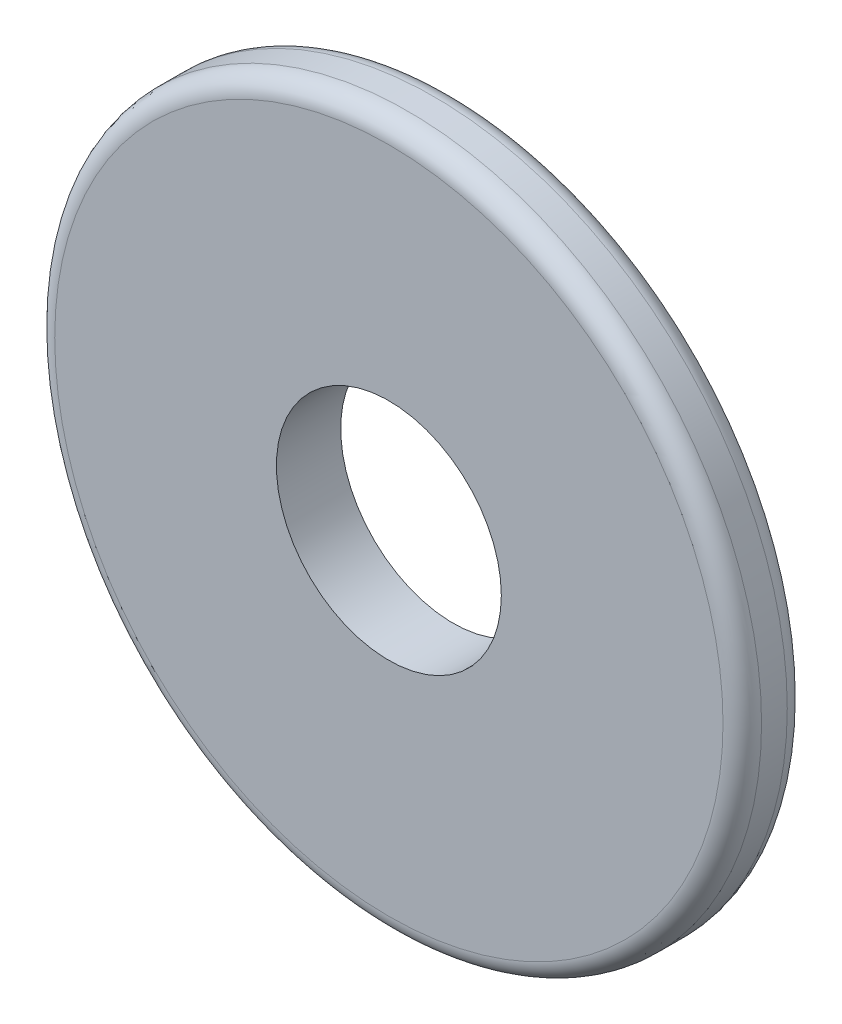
SolidWorks part; units mm, degrees
ref_plane "Plan1" through (0, 0, 0) normal (0, 0, 1) x (1, 0, 0)
ref_plane "Plan2" through (0, 0, 0) normal (0, 1, 0) x (1, 0, 0)
ref_plane "Plan3" through (0, 0, 0) normal (1, 0, 0) x (0, 0, -1)
sketch "Esquisse1" plane through (0, 0, 0) normal (0, 0, 1) x (1, 0, 0)
  circle A0 centre (0, 0) radius 5.5
  circle A1 centre (0, 0) radius 1.75
  dimension "D1" = 3.5
  dimension "D2" = 11
extrude "Base-Extrusion" add sketch "Esquisse1" along normal blind 1
fillet "Congé1" radius 0.3 2 edges at (5.5, 0, 0) (5.5, 0, 1)
